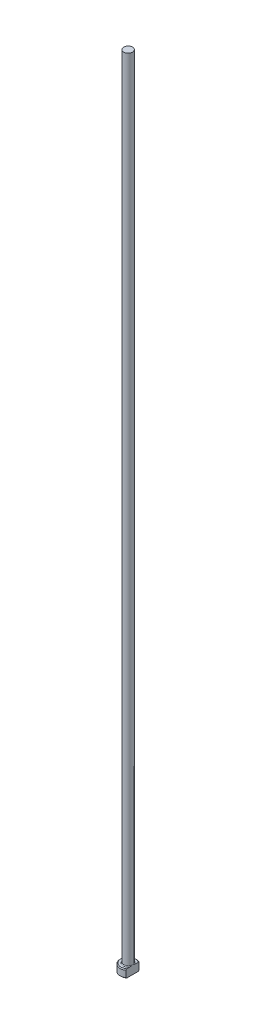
SolidWorks part; units mm, degrees
ref_plane "Front Plane" through (0, 0, 0) normal (0, 0, 1) x (1, 0, 0)
ref_plane "Top Plane" through (0, 0, 0) normal (0, 1, 0) x (1, 0, 0)
ref_plane "Right Plane" through (0, 0, 0) normal (1, 0, 0) x (0, 0, -1)
sketch "Sketch1" plane through (0, 0, 0) normal (0, 0, 1) x (1, 0, 0)
  line L0 (0, 259.9588) -> (0, -15.1925) construction
  line L1 (0, 0) -> (-2, 0)
  line L2 (-2, 0) -> (-2, 2)
  line L3 (-2, 2) -> (-1.1, 2)
  line L4 (-1.1, 2) -> (-1.1, 200)
  line L5 (-1.1, 200) -> (0, 200)
  line L6 (0, 200) -> (0, 0)
  dimension "L" = 200
  dimension "H" = 4
  dimension "T" = 2
  dimension "D" = 2.2
revolve "Revolve1" add sketch "Sketch1" angle 360 about L0
chamfer "Chamfer1" distance 0.2 angle 45 2 edges at (0, 2, 2) (0, 0, 2)
fillet "Fillet1" radius 0.2 1 edges at (0, 2, 1.1)
sketch "Sketch2" plane through (0, 0, 0) normal (0, 1, 0) x (1, 0, 0)
  line L0 (1.1, 1.6703) -> (1.1, -1.6703)
  circle A0 centre (0, 0) radius 2 construction
  arc A1 (1.1, -1.6703) -> (1.1, 1.6703) centre (0, 0) ccw
  circle A2 centre (0, 0) radius 1.1 construction
extrude "KEY" cut sketch "Sketch2" along normal through all
